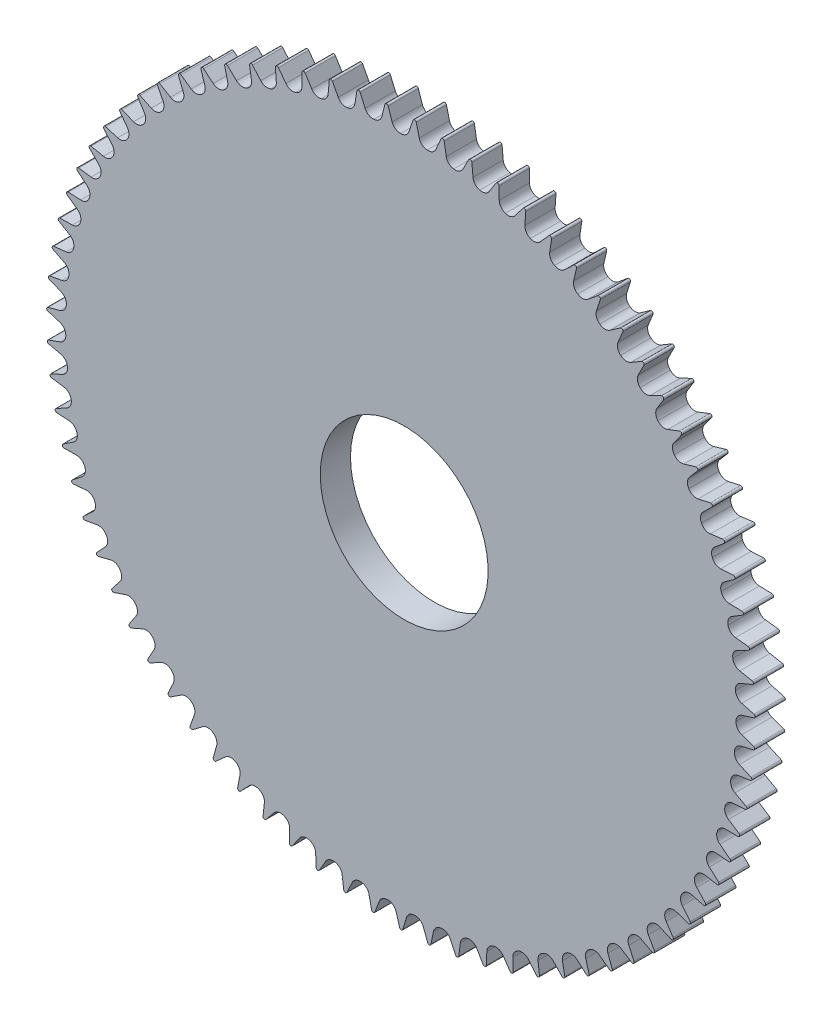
SolidWorks part; units mm, degrees
ref_plane "Plan1" through (0, 0, 0) normal (0, 0, 1) x (1, 0, 0)
ref_plane "Plan2" through (0, 0, 0) normal (0, 1, 0) x (1, 0, 0)
ref_plane "Plan3" through (0, 0, 0) normal (1, 0, 0) x (0, 0, -1)
sketch "Esquisse1" plane through (0, 0, 0) normal (0, 0, 1) x (1, 0, 0)
  line L0 (-13.3047, 202.9744) -> (-11.4948, 210.2179)
  line L1 (-9.5775, 210.2961) -> (-7.1837, 203.224)
  line L2 (-29.3871, 201.4322) -> (-28.1584, 208.7966)
  line L3 (-26.2533, 209.0269) -> (-23.3053, 202.1674)
  line L4 (-45.2961, 198.6172) -> (-44.6564, 206.0559)
  line L5 (-42.7756, 206.4368) -> (-39.2919, 199.8332)
  line L6 (-60.9311, 194.547) -> (-60.8844, 202.0131)
  line L7 (-59.0398, 202.5422) -> (-55.0425, 196.2363)
  line L8 (-76.1933, 189.2476) -> (-76.74, 196.6937)
  line L9 (-74.9433, 197.3677) -> (-70.4576, 191.3993)
  line L10 (-90.9863, 182.7523) -> (-92.1228, 190.1314)
  line L11 (-90.3853, 190.9461) -> (-85.4396, 185.3529)
  line L12 (-105.2164, 175.1022) -> (-106.9356, 182.3678)
  line L13 (-105.2683, 183.3179) -> (-99.8939, 178.1353)
  line L14 (-118.7938, 166.3458) -> (-121.0848, 173.4517)
  line L15 (-119.4983, 174.5313) -> (-113.729, 169.7921)
  line L16 (2.8493, 203.234) -> (5.229, 210.3107)
  line L17 (7.1465, 210.2363) -> (8.9708, 202.9965)
  line L18 (-131.6325, 156.5382) -> (-134.4808, 163.4397)
  line L19 (-132.9851, 164.6419) -> (-126.8576, 160.3761)
  line L20 (-143.6514, 145.7417) -> (-147.0391, 152.3951)
  line L21 (-145.6436, 153.7123) -> (-139.1965, 149.9468)
  line L22 (-154.7746, 134.0244) -> (-158.6801, 140.3876)
  line L23 (-157.3937, 141.8115) -> (-150.6679, 138.5701)
  line L24 (-164.9316, 121.4604) -> (-169.3304, 127.4931)
  line L25 (-168.1612, 129.0148) -> (-161.1991, 126.318)
  line L26 (-174.0583, 108.1291) -> (-178.9225, 113.7933)
  line L27 (-177.8779, 115.403) -> (-170.7235, 113.2679)
  line L28 (-182.097, 94.1148) -> (-187.3959, 99.3747)
  line L29 (-186.4824, 101.0623) -> (-179.181, 99.5024)
  line L30 (-188.9969, 79.5062) -> (-194.6969, 84.3284)
  line L31 (-193.9204, 86.0833) -> (-186.5182, 85.1084)
  line L32 (-194.7143, 64.3955) -> (-200.7794, 68.7497)
  line L33 (-200.1448, 70.5607) -> (-192.6885, 70.177)
  line L34 (-199.213, 48.8784) -> (-205.6049, 52.7369)
  line L35 (-205.1162, 54.5926) -> (-197.653, 54.8025)
  line L36 (-202.4647, 33.0529) -> (-209.1429, 36.3914)
  line L37 (-208.8032, 38.28) -> (-201.3803, 39.0822)
  line L38 (-204.4488, 17.0191) -> (-211.3712, 19.8164)
  line L39 (-211.1826, 21.7261) -> (-203.8468, 23.1155)
  line L40 (-205.1528, 0.8783) -> (-212.2755, 3.1168)
  line L41 (-212.2392, 5.0355) -> (-205.037, 7.0033)
  line L42 (-204.5721, -15.2674) -> (-211.8501, -13.6018)
  line L43 (-211.9664, -11.6864) -> (-204.9433, -9.1525)
  line L44 (-202.7105, -31.3159) -> (-210.0978, -30.2338)
  line L45 (-210.3659, -28.3337) -> (-203.5664, -25.2499)
  line L46 (-199.5797, -47.1657) -> (-207.0296, -46.6741)
  line L47 (-207.4478, -44.8012) -> (-200.9148, -41.1869)
  line L48 (-195.1995, -62.7168) -> (-202.6649, -62.8185)
  line L49 (-203.2307, -60.9848) -> (-197.0054, -56.8629)
  line L50 (-189.5976, -77.8706) -> (-197.0314, -78.5652)
  line L51 (-197.741, -76.7822) -> (-191.863, -72.1788)
  line L52 (-182.8095, -92.5315) -> (-190.1646, -93.8145)
  line L53 (-191.0136, -92.0936) -> (-185.5199, -87.0376)
  line L54 (-174.878, -106.6067) -> (-182.1079, -108.47)
  line L55 (-183.091, -106.822) -> (-178.0163, -101.3455)
  line L56 (-165.8533, -120.0073) -> (-172.9123, -122.4391)
  line L57 (-174.0232, -120.8744) -> (-169.3997, -115.0121)
  line L58 (-155.7925, -132.6485) -> (-162.636, -135.6335)
  line L59 (-163.8677, -134.1619) -> (-159.7245, -127.9508)
  line L60 (-144.7591, -144.4504) -> (-151.3438, -147.9696)
  line L61 (-152.6885, -146.6006) -> (-149.052, -140.08)
  line L62 (-132.823, -155.3384) -> (-139.1072, -159.3697)
  line L63 (-140.5565, -158.1118) -> (-137.4495, -151.3228)
  line L64 (-120.0595, -165.2436) -> (-126.0036, -169.7614)
  line L65 (-127.5482, -168.6227) -> (-124.9904, -161.6083)
  line L66 (-106.5494, -174.1035) -> (-112.1158, -179.0793)
  line L67 (-113.7459, -178.0669) -> (-111.7535, -170.8715)
  line L68 (-92.3781, -181.8619) -> (-97.5315, -187.2643)
  line L69 (-99.237, -186.3846) -> (-97.8225, -179.0536)
  line L70 (-77.6351, -188.47) -> (-82.3431, -194.2647)
  line L71 (-84.1131, -193.5233) -> (-83.2855, -186.1031)
  line L72 (-62.4138, -193.8858) -> (-66.6465, -200.0362)
  line L73 (-68.4698, -199.4378) -> (-68.2344, -191.9753)
  line L74 (-46.8103, -198.0752) -> (-50.5409, -204.5424)
  line L75 (-52.406, -204.0908) -> (-52.7643, -196.6332)
  line L76 (-30.9233, -201.0116) -> (-34.1283, -207.7548)
  line L77 (-36.0233, -207.4527) -> (-36.973, -200.0472)
  line L78 (-14.8532, -202.6765) -> (-17.5123, -209.653)
  line L79 (-19.4254, -209.5025) -> (-20.9604, -202.1958)
  line L80 (1.2984, -203.0594) -> (-0.798, -210.2251)
  line L81 (-2.717, -210.227) -> (-4.8277, -203.0654)
  line L82 (17.4294, -202.1578) -> (15.9089, -209.4675)
  line L83 (13.9961, -209.6218) -> (11.3231, -202.6505)
  line L84 (33.4377, -199.9774) -> (32.5027, -207.3848)
  line L85 (30.6083, -207.6907) -> (27.3899, -200.9538)
  line L86 (49.2222, -196.5321) -> (48.8787, -203.9904)
  line L87 (47.0145, -204.4458) -> (43.2711, -197.9859)
  line L88 (64.683, -191.8436) -> (64.9332, -199.3056)
  line L89 (63.1111, -199.9077) -> (58.8662, -193.7656)
  line L90 (79.7225, -185.9416) -> (80.5648, -193.3601)
  line L91 (78.7963, -194.105) -> (74.0768, -188.3196)
  line L92 (94.2455, -178.8633) -> (95.6745, -186.1914)
  line L93 (93.9708, -187.0745) -> (88.8066, -181.6824)
  line L94 (108.1603, -170.6535) -> (110.167, -177.845)
  line L95 (108.5388, -178.8606) -> (102.9625, -173.8958)
  line L96 (121.3788, -161.3642) -> (123.9505, -168.3735)
  line L97 (122.4081, -169.5153) -> (116.4551, -165.0092)
  line L98 (133.8174, -151.054) -> (136.9379, -157.8368)
  line L99 (135.4911, -159.0975) -> (129.1989, -155.0787)
  line L100 (145.3976, -139.7882) -> (149.0471, -146.3016)
  line L101 (147.7051, -147.6733) -> (141.1134, -144.1671)
  line L102 (156.0461, -127.6379) -> (160.2016, -133.8408)
  line L103 (158.9728, -135.3148) -> (152.1234, -132.3433)
  line L104 (165.6956, -114.68) -> (170.3308, -120.5331)
  line L105 (169.223, -122.1001) -> (162.1592, -119.6822)
  line L106 (174.2851, -100.9964) -> (179.3707, -106.4628)
  line L107 (178.3909, -108.1128) -> (171.1573, -106.2638)
  line L108 (181.7603, -86.6737) -> (187.2641, -91.7187)
  line L109 (186.4185, -93.4413) -> (179.0608, -92.1729)
  line L110 (188.0739, -71.8023) -> (193.9611, -76.3941)
  line L111 (193.255, -78.1784) -> (185.8199, -77.4986)
  line L112 (193.1861, -56.4763) -> (199.4194, -60.5858)
  line L113 (198.8574, -62.4206) -> (191.3917, -62.3337)
  line L114 (197.0644, -40.7925) -> (203.6045, -44.3939)
  line L115 (203.19, -46.2675) -> (195.7411, -46.774)
  line L116 (199.6843, -24.8503) -> (206.49, -27.9206)
  line L117 (206.2256, -29.8213) -> (198.8404, -30.918)
  line L118 (201.0294, -8.7502) -> (208.0575, -11.2702)
  line L119 (207.945, -13.1858) -> (200.6703, -14.8658)
  line L120 (201.0911, 7.4058) -> (208.2971, 5.4522)
  line L121 (208.3372, 3.5336) -> (201.2189, 1.281)
  line L122 (199.8689, 23.5156) -> (207.2074, 22.1407)
  line L123 (207.3998, 20.2314) -> (200.483, 17.4203)
  line L124 (197.3708, 39.4774) -> (204.7953, 38.6899)
  line L125 (205.1387, 36.8019) -> (198.4672, 33.4502)
  line L126 (193.6123, 55.1902) -> (201.0759, 54.9951)
  line L127 (201.5683, 53.1404) -> (195.1841, 49.2692)
  line L128 (188.6173, 70.5548) -> (196.0729, 70.9533)
  line L129 (196.711, 69.1436) -> (190.6546, 64.7774)
  line L130 (182.4174, 85.474) -> (189.8177, 86.4636)
  line L131 (190.5977, 84.7102) -> (184.9073, 79.8767)
  line L132 (175.0518, 99.8534) -> (182.3501, 101.4278)
  line L133 (183.2669, 99.742) -> (177.9785, 94.4716)
  line L134 (166.567, 113.6022) -> (173.7171, 115.7515)
  line L135 (174.765, 114.1438) -> (169.912, 108.4699)
  line L136 (157.0167, 126.6334) -> (163.9735, 129.3439)
  line L137 (165.1457, 127.8246) -> (160.7589, 121.7831)
  line L138 (146.4613, 138.8646) -> (153.1807, 142.1193)
  line L139 (154.4699, 140.6979) -> (150.577, 134.327)
  line L140 (134.9674, 150.2185) -> (141.407, 153.9968)
  line L141 (142.8051, 152.6823) -> (139.4306, 146.0222)
  line L142 (122.6078, 160.6233) -> (128.7269, 164.9013)
  line L143 (130.225, 163.7021) -> (127.3903, 156.7949)
  line L144 (109.4606, 170.0133) -> (115.2204, 174.7639)
  line L145 (116.8091, 173.6875) -> (114.5322, 166.577)
  line L146 (95.609, 178.329) -> (100.9731, 183.5222)
  line L147 (102.6423, 182.5754) -> (100.9375, 175.3065)
  line L148 (81.1404, 185.518) -> (86.075, 191.121)
  line L149 (87.8141, 190.3098) -> (86.6922, 182.9284)
  line L150 (66.1464, 191.5347) -> (70.6203, 197.512)
  line L151 (72.4183, 196.8415) -> (71.8864, 189.3943)
  line L152 (50.7218, 196.3411) -> (54.7066, 202.6549)
  line L153 (56.5523, 202.1294) -> (56.6137, 194.6635)
  line L154 (34.9641, 199.9068) -> (38.4347, 206.5173)
  line L155 (40.3162, 206.1401) -> (40.9707, 198.7027)
  line L156 (18.9729, 202.2093) -> (21.9073, 209.0746)
  line L157 (23.8128, 208.8481) -> (25.0561, 201.4862)
  line L158 (-1.9659, 0.1027) -> (-2.164, 199.777) construction
  line L159 (-1.9659, 0.1027) -> (-18.0275, 199.13) construction
  circle A0 centre (0, 0) radius 204.75 construction
  arc A1 (-2.164, 199.777) -> (2.8493, 203.234) centre (-1.9658, 204.8531) ccw
  arc A2 (8.9708, 202.9965) -> (13.7008, 199.1615) centre (13.8968, 204.2377) ccw
  arc A3 (-18.0275, 199.13) -> (-13.3047, 202.9744) centre (-18.2332, 204.2059) ccw
  arc A4 (-11.4948, 210.2179) -> (-9.5775, 210.2961) centre (-10.5247, 209.9755) cw
  arc A5 (-7.1837, 203.224) -> (-2.164, 199.777) centre (-2.3719, 204.8527) ccw
  arc A6 (-33.7895, 197.2248) -> (-29.3871, 201.4322) centre (-34.3978, 202.2682) ccw
  arc A7 (-28.1584, 208.7966) -> (-26.2533, 209.0269) centre (-27.172, 208.632) cw
  arc A8 (-23.3053, 202.1674) -> (-18.0275, 199.13) centre (-18.638, 204.1732) ccw
  arc A9 (-49.3502, 194.0733) -> (-45.2961, 198.6172) centre (-50.3574, 199.0524) ccw
  arc A10 (-44.6564, 206.0559) -> (-42.7756, 206.4368) centre (-43.66, 205.9702) cw
  arc A11 (-39.2919, 199.8332) -> (-33.7895, 197.2248) centre (-34.7988, 202.2035) ccw
  arc A12 (-64.6115, 189.6954) -> (-60.9311, 194.547) centre (-66.011, 194.5788) ccw
  arc A13 (-60.8844, 202.0131) -> (-59.0398, 202.5422) centre (-59.8844, 202.0068) cw
  arc A14 (-55.0425, 196.2363) -> (-49.3502, 194.0733) centre (-50.7519, 198.9561) ccw
  arc A15 (-79.4766, 184.1189) -> (-76.1933, 189.2476) centre (-81.2597, 188.8756) ccw
  arc A16 (-76.74, 196.6937) -> (-74.9433, 197.3677) centre (-75.7427, 196.7669) cw
  arc A17 (-70.4576, 191.3993) -> (-64.6115, 189.6954) centre (-66.3966, 194.4514) ccw
  arc A18 (-93.8517, 177.3789) -> (-90.9863, 182.7523) centre (-96.0071, 181.979) ccw
  arc A19 (-92.1228, 190.1314) -> (-90.3853, 190.9461) centre (-91.1345, 190.2837) cw
  arc A20 (-85.4396, 185.3529) -> (-79.4766, 184.1189) centre (-81.634, 188.718) ccw
  arc A21 (-107.6458, 169.5182) -> (-105.2164, 175.1022) centre (-110.1599, 173.9325) ccw
  arc A22 (-106.9356, 182.3678) -> (-105.2683, 183.3179) centre (-105.9625, 182.598) cw
  arc A23 (-99.8939, 178.1353) -> (-93.8517, 177.3789) centre (-96.3677, 181.7921) ccw
  arc A24 (-120.7719, 160.5864) -> (-118.7938, 166.3458) centre (-123.6287, 164.7869) ccw
  arc A25 (-121.0848, 173.4517) -> (-119.4983, 174.5313) centre (-120.133, 173.7586) cw
  arc A26 (-113.729, 169.7921) -> (-107.6458, 169.5182) centre (-110.5045, 173.7175) ccw
  arc A27 (-133.1467, 150.6399) -> (-131.6325, 156.5382) centre (-136.3283, 154.6002) ccw
  arc A28 (-134.4808, 163.4397) -> (-132.9851, 164.6419) centre (-133.5565, 163.8212) cw
  arc A29 (-126.8576, 160.3761) -> (-120.7719, 160.5864) centre (-123.9551, 164.5453) ccw
  arc A30 (-144.6923, 139.7417) -> (-143.6514, 145.7417) centre (-148.1784, 143.4367) ccw
  arc A31 (-147.0391, 152.3951) -> (-145.6436, 153.7123) centre (-146.1479, 152.8488) cw
  arc A32 (-139.1965, 149.9468) -> (-133.1467, 150.6399) centre (-136.6345, 154.3334) ccw
  arc A33 (-155.3354, 127.9606) -> (-154.7746, 134.0244) centre (-159.1041, 131.367) ccw
  arc A34 (5.229, 210.3107) -> (7.1465, 210.2363) centre (6.1768, 209.992) cw
  arc A35 (-158.6801, 140.3876) -> (-157.3937, 141.8115) centre (-157.8279, 140.9107) cw
  arc A36 (-150.6679, 138.5701) -> (-144.6923, 139.7417) centre (-148.4624, 143.1464) ccw
  arc A37 (-165.0089, 115.3712) -> (-164.9316, 121.4604) centre (-169.0363, 118.4674) ccw
  arc A38 (-169.3304, 127.4931) -> (-168.1612, 129.0148) centre (-168.5224, 128.0823) cw
  arc A39 (-161.1991, 126.318) -> (-155.3354, 127.9606) centre (-159.3642, 131.0551) ccw
  arc A40 (-173.6516, 102.0531) -> (-174.0583, 108.1291) centre (-177.9123, 104.8195) ccw
  arc A41 (-178.9225, 113.7933) -> (-177.8779, 115.403) centre (-178.1639, 114.4448) cw
  arc A42 (-170.7235, 113.2679) -> (-165.0089, 115.3712) centre (-169.2708, 118.1358) ccw
  arc A43 (-181.2089, 88.0903) -> (-182.097, 94.1148) centre (-185.6759, 90.5095) ccw
  arc A44 (-187.3959, 99.3747) -> (-186.4824, 101.0623) centre (-186.6914, 100.0844) cw
  arc A45 (-179.181, 99.5024) -> (-173.6516, 102.0531) centre (-178.1197, 104.4703) ccw
  arc A46 (-187.6329, 73.5713) -> (-188.9969, 79.5062) centre (-192.278, 75.6279) ccw
  arc A47 (-194.6969, 84.3284) -> (-193.9204, 86.0833) centre (-194.051, 85.0919) cw
  arc A48 (-186.5182, 85.1084) -> (-181.2089, 88.0903) centre (-185.8548, 90.1449) ccw
  arc A49 (-192.883, 58.5878) -> (-194.7143, 64.3955) centre (-197.6768, 60.2688) ccw
  arc A50 (-200.7794, 68.7497) -> (-200.1448, 70.5607) centre (-200.1962, 69.562) cw
  arc A51 (-192.6885, 70.177) -> (-187.6329, 73.5713) centre (-192.4274, 75.2503) ccw
  arc A52 (-196.9262, 43.2345) -> (-199.213, 48.8784) centre (-201.8384, 44.5294) ccw
  arc A53 (-205.6049, 52.7369) -> (-205.1162, 54.5926) centre (-205.0881, 53.593) cw
  arc A54 (-197.653, 54.8025) -> (-192.883, 58.5878) centre (-197.7958, 59.8805) ccw
  arc A55 (-199.7367, 27.6085) -> (-202.4647, 33.0529) centre (-204.7363, 28.509) ccw
  arc A56 (-209.1429, 36.3914) -> (-208.8032, 38.28) centre (-208.6958, 37.2858) cw
  arc A57 (-201.3803, 39.0822) -> (-196.9262, 43.2345) centre (-201.9261, 44.1328) ccw
  arc A58 (-201.2969, 11.8087) -> (-204.4488, 17.0191) centre (-206.3521, 12.3091) ccw
  arc A59 (-211.3712, 19.8164) -> (-211.1826, 21.7261) centre (-210.9965, 20.7436) cw
  arc A60 (-203.8468, 23.1155) -> (-199.7367, 27.6085) centre (-204.7922, 28.1068) ccw
  arc A61 (-201.5968, -4.0652) -> (-205.1528, 0.8783) centre (-206.6759, -3.968) ccw
  arc A62 (-212.2755, 3.1168) -> (-212.2392, 5.0355) centre (-211.9756, 4.0708) cw
  arc A63 (-205.037, 7.0033) -> (-201.2969, 11.8087) centre (-206.376, 11.9037) ccw
  arc A64 (-200.6346, -19.9127) -> (-204.5721, -15.2674) centre (-205.7053, -20.2194) ccw
  arc A65 (-211.8501, -13.6018) -> (-211.9664, -11.6864) centre (-211.627, -12.627) cw
  arc A66 (-204.9433, -9.1525) -> (-201.5968, -4.0652) centre (-206.6674, -4.374) ccw
  arc A67 (-198.4163, -35.6337) -> (-202.7105, -31.3159) centre (-203.4467, -36.3422) ccw
  arc A68 (-210.0978, -30.2338) -> (-210.3659, -28.3337) centre (-209.9529, -29.2444) cw
  arc A69 (-203.5664, -25.2499) -> (-200.6346, -19.9127) centre (-205.6646, -20.6234) ccw
  arc A70 (-194.956, -51.1288) -> (-199.5797, -47.1657) centre (-199.9142, -52.2347) ccw
  arc A71 (-207.0296, -46.6741) -> (-207.4478, -44.8012) centre (-206.9638, -45.6762) cw
  arc A72 (-200.9148, -41.1869) -> (-198.4163, -35.6337) centre (-203.374, -36.7418) ccw
  arc A73 (-190.2756, -66.2999) -> (-195.1995, -62.7168) centre (-195.1302, -67.7963) ccw
  arc A74 (-202.6649, -62.8185) -> (-203.2307, -60.9848) centre (-202.6786, -61.8186) cw
  arc A75 (-197.0054, -56.8629) -> (-194.956, -51.1288) centre (-199.81, -52.6273) ccw
  arc A76 (-184.4046, -81.0512) -> (-189.5976, -77.8706) centre (-189.125, -82.9286) ccw
  arc A77 (-197.0314, -78.5652) -> (-197.741, -76.7822) centre (-197.1244, -77.5695) cw
  arc A78 (-191.863, -72.1788) -> (-190.2756, -66.2999) centre (-194.9952, -68.1793) ccw
  arc A79 (-177.3802, -95.2895) -> (-182.8095, -92.5315) centre (-181.9365, -97.5359) ccw
  arc A80 (-190.1646, -93.8145) -> (-191.0136, -92.0936) centre (-190.3364, -92.8294) cw
  arc A81 (-185.5199, -87.0376) -> (-184.4046, -81.0512) centre (-188.96, -83.2997) ccw
  arc A82 (-169.2468, -108.9246) -> (-174.878, -106.6067) centre (-173.6102, -111.526) ccw
  arc A83 (-182.1079, -108.47) -> (-183.091, -106.822) centre (-182.3575, -107.5017) cw
  arc A84 (-178.0163, -101.3455) -> (-177.3802, -95.2895) centre (-181.7425, -97.8927) ccw
  arc A85 (-160.0557, -121.8705) -> (-165.8533, -120.0073) centre (-164.1987, -124.8103) ccw
  arc A86 (-172.9123, -122.4391) -> (-174.0232, -120.8744) centre (-173.2381, -121.4936) cw
  arc A87 (-169.3997, -115.0121) -> (-169.2468, -108.9246) centre (-173.3885, -111.8662) ccw
  arc A88 (-149.8652, -134.0452) -> (-155.7925, -132.6485) centre (-153.7615, -137.3048) ccw
  arc A89 (-162.636, -135.6335) -> (-163.8677, -134.1619) centre (-163.0358, -134.7169) cw
  arc A90 (-159.7245, -127.9508) -> (-160.0557, -121.8705) centre (-163.9506, -125.1318) ccw
  arc A91 (-138.7396, -145.3717) -> (-144.7591, -144.4504) centre (-142.3646, -148.9306) ccw
  arc A92 (-151.3438, -147.9696) -> (-152.6885, -146.6006) centre (-151.8152, -147.0877) cw
  arc A93 (-149.052, -140.08) -> (-149.8652, -134.0452) centre (-153.4886, -137.6056) ccw
  arc A94 (-126.7493, -155.7785) -> (-132.823, -155.3384) centre (-130.08, -159.6142) ccw
  arc A95 (-139.1072, -159.3697) -> (-140.5565, -158.1118) centre (-139.6472, -158.528) cw
  arc A96 (-137.4495, -151.3228) -> (-138.7396, -145.3717) centre (-142.0687, -149.2088) ccw
  arc A97 (-113.97, -165.1998) -> (-120.0595, -165.2436) centre (-116.9855, -169.288) ccw
  arc A98 (-126.0036, -169.7614) -> (-127.5482, -168.6227) centre (-126.6087, -168.9653) cw
  arc A99 (-124.9904, -161.6083) -> (-126.7493, -155.7785) centre (-129.763, -159.868) ccw
  arc A100 (-100.4826, -173.576) -> (-106.5494, -174.1035) centre (-103.1638, -177.8908) ccw
  arc A101 (-112.1158, -179.0793) -> (-113.7459, -178.0669) centre (-112.7822, -178.3337) cw
  arc A102 (-111.7535, -170.8715) -> (-113.97, -165.1998) centre (-116.6493, -169.5158) ccw
  arc A103 (-86.3724, -180.8542) -> (-92.3781, -181.8619) centre (-88.7023, -185.3684) ccw
  arc A104 (-97.5315, -187.2643) -> (-99.237, -186.3846) centre (-98.2551, -186.574) cw
  arc A105 (-97.8225, -179.0536) -> (-100.4826, -173.576) centre (-102.8105, -178.0912) ccw
  arc A106 (-71.7285, -186.9882) -> (-77.6351, -188.47) centre (-73.6924, -191.6733) ccw
  arc A107 (-82.3431, -194.2647) -> (-84.1131, -193.5233) centre (-83.1192, -193.6341) cw
  arc A108 (-83.2855, -186.1031) -> (-86.3724, -180.8542) centre (-88.3342, -185.5401) ccw
  arc A109 (-56.6436, -191.9395) -> (-62.4138, -193.8858) centre (-58.229, -196.7657) ccw
  arc A110 (-66.6465, -200.0362) -> (-68.4698, -199.4378) centre (-67.4703, -199.4693) cw
  arc A111 (-68.2344, -191.9753) -> (-71.7285, -186.9882) centre (-73.3118, -191.8152) ccw
  arc A112 (-41.213, -195.6765) -> (-46.8103, -198.0752) centre (-42.4099, -200.6135) ccw
  arc A113 (-50.5409, -204.5424) -> (-52.406, -204.0908) centre (-51.4071, -204.0428) cw
  arc A114 (-52.7643, -196.6332) -> (-56.6436, -191.9395) centre (-57.8384, -196.8769) ccw
  arc A115 (-25.5342, -198.1758) -> (-30.9233, -201.0116) centre (-26.3351, -203.1923) ccw
  arc A116 (-34.1283, -207.7548) -> (-36.0233, -207.4527) centre (-35.0315, -207.3255) cw
  arc A117 (-36.973, -200.0472) -> (-41.213, -195.6765) centre (-42.0117, -200.6933) ccw
  arc A118 (-9.7064, -199.4215) -> (-14.8532, -202.6765) centre (-10.1063, -204.4858) ccw
  arc A119 (-17.5123, -209.653) -> (-19.4254, -209.5025) centre (-18.4467, -209.2969) cw
  arc A120 (-20.9604, -202.1958) -> (-25.5342, -198.1758) centre (-25.9318, -203.2402) ccw
  arc A121 (6.1703, -199.4058) -> (1.2984, -203.0594) centre (6.174, -204.4858) ccw
  arc A122 (-0.798, -210.2251) -> (-2.717, -210.227) centre (-1.7578, -209.9443) cw
  arc A123 (-4.8277, -203.0654) -> (-9.7064, -199.4215) centre (-9.7004, -204.5015) ccw
  arc A124 (21.9955, -198.1287) -> (17.4294, -202.1578) centre (22.4029, -203.1923) ccw
  arc A125 (15.9089, -209.4675) -> (13.9961, -209.6218) centre (14.9298, -209.2638) cw
  arc A126 (11.3231, -202.6505) -> (6.1703, -199.4058) centre (6.5798, -204.4692) ccw
  arc A127 (37.6693, -195.5983) -> (33.4377, -199.9774) centre (38.4777, -200.6136) ccw
  arc A128 (32.5027, -207.3848) -> (30.6083, -207.6907) centre (31.5106, -207.2596) cw
  arc A129 (27.3899, -200.9538) -> (21.9955, -198.1287) centre (22.8061, -203.1436) ccw
  arc A130 (53.0925, -191.8306) -> (49.2222, -196.5321) centre (54.2968, -196.7658) ccw
  arc A131 (48.8787, -203.9904) -> (47.0145, -204.4458) centre (47.8798, -203.9444) cw
  arc A132 (43.2711, -197.9859) -> (37.6693, -195.5983) centre (38.8758, -200.533) ccw
  arc A133 (68.1676, -186.8495) -> (64.683, -191.8436) centre (69.7602, -191.6734) ccw
  arc A134 (64.9332, -199.3056) -> (63.1111, -199.9077) centre (63.9338, -199.3391) cw
  arc A135 (58.8662, -193.7656) -> (53.0925, -191.8306) centre (54.6872, -196.6538) ccw
  arc A136 (82.7993, -180.6864) -> (79.7225, -185.9416) centre (84.7701, -185.3685) ccw
  arc A137 (80.5648, -193.3601) -> (78.7963, -194.105) centre (79.5711, -193.4729) cw
  arc A138 (74.0768, -188.3196) -> (68.1676, -186.8495) centre (70.1404, -191.5308) ccw
  arc A139 (96.895, -173.3803) -> (94.2455, -178.8633) centre (99.2316, -177.891) ccw
  arc A140 (95.6745, -186.1914) -> (93.9708, -187.0745) centre (94.693, -186.3828) cw
  arc A141 (88.8066, -181.6824) -> (82.7993, -180.6864) centre (85.1378, -185.1961) ccw
  arc A142 (110.3658, -164.9773) -> (108.1603, -170.6535) centre (113.0533, -169.2882) ccw
  arc A143 (110.167, -177.845) -> (108.5388, -178.8606) centre (109.2038, -178.1138) cw
  arc A144 (102.9625, -173.8958) -> (96.895, -173.3803) centre (99.5845, -177.6899) ccw
  arc A145 (123.1263, -155.5307) -> (121.3788, -161.3642) centre (126.1479, -159.6144) ccw
  arc A146 (123.9505, -168.3735) -> (122.4081, -169.5153) centre (123.0117, -168.7179) cw
  arc A147 (116.4551, -165.0092) -> (110.3658, -164.9773) centre (113.3891, -169.0597) ccw
  arc A148 (135.096, -145.1001) -> (133.8174, -151.054) centre (138.4325, -148.9309) ccw
  arc A149 (136.9379, -157.8368) -> (135.4911, -159.0975) centre (136.0294, -158.2548) cw
  arc A150 (129.1989, -155.0787) -> (123.1263, -155.5307) centre (126.4645, -159.36) ccw
  arc A151 (146.1991, -133.7515) -> (145.3976, -139.7882) centre (149.8294, -137.3051) ccw
  arc A152 (149.0471, -146.3016) -> (147.7051, -147.6733) centre (148.1747, -146.7904) cw
  arc A153 (141.1134, -144.1671) -> (135.096, -145.1001) centre (138.7278, -148.6521) ccw
  arc A154 (156.3655, -121.5567) -> (156.0461, -127.6379) centre (160.2666, -124.8105) ccw
  arc A155 (160.2016, -133.8408) -> (158.9728, -135.3148) centre (159.3708, -134.3974) cw
  arc A156 (152.1234, -132.3433) -> (146.1991, -133.7515) centre (150.1016, -137.0037) ccw
  arc A157 (165.5308, -108.5926) -> (165.6956, -114.68) centre (169.6781, -111.5263) ccw
  arc A158 (170.3308, -120.5331) -> (169.223, -122.1001) centre (169.5468, -121.154) cw
  arc A159 (162.1592, -119.6822) -> (156.3655, -121.5567) centre (160.5141, -124.4885) ccw
  arc A160 (173.6372, -94.9414) -> (174.2851, -100.9964) centre (178.0045, -97.5362) ccw
  arc A161 (179.3707, -106.4628) -> (178.3909, -108.1128) centre (178.6385, -107.1439) cw
  arc A162 (171.1573, -106.2638) -> (165.5308, -108.5926) centre (169.8992, -111.1856) ccw
  arc A163 (180.6334, -80.6892) -> (181.7603, -86.6737) centre (185.193, -82.9289) ccw
  arc A164 (187.2641, -91.7187) -> (186.4185, -93.4413) centre (186.5884, -92.4559) cw
  arc A165 (179.0608, -92.1729) -> (173.6372, -94.9414) centre (178.1978, -97.1791) ccw
  arc A166 (186.4751, -65.9263) -> (188.0739, -71.8023) centre (191.1982, -67.7966) ccw
  arc A167 (193.9611, -76.3941) -> (193.255, -78.1784) centre (193.3461, -77.1826) cw
  arc A168 (185.8199, -77.4986) -> (180.6334, -80.6892) centre (185.3573, -82.5575) ccw
  arc A169 (191.1254, -50.7459) -> (193.1861, -56.4763) centre (195.9822, -52.235) ccw
  arc A170 (199.4194, -60.5858) -> (198.8574, -62.4206) centre (198.869, -61.4207) cw
  arc A171 (191.3917, -62.3337) -> (186.4751, -65.9263) centre (191.3325, -67.4133) ccw
  arc A172 (194.5549, -35.244) -> (197.0644, -40.7925) centre (199.5147, -36.3426) ccw
  arc A173 (203.6045, -44.3939) -> (203.19, -46.2675) centre (203.1222, -45.2698) cw
  arc A174 (195.7411, -46.774) -> (191.1254, -50.7459) centre (196.0857, -51.8423) ccw
  arc A175 (196.742, -19.5187) -> (199.6843, -24.8503) centre (201.7734, -20.2197) ccw
  arc A176 (206.49, -27.9206) -> (206.2256, -29.8213) centre (206.0787, -28.8321) cw
  arc A177 (198.8404, -30.918) -> (194.5549, -35.244) centre (199.5866, -35.9429) ccw
  arc A178 (197.6728, -3.6693) -> (201.0294, -8.7502) centre (202.744, -3.9683) ccw
  arc A179 (208.0575, -11.2702) -> (207.945, -13.1858) centre (207.72, -12.2115) cw
  arc A180 (200.6703, -14.8658) -> (196.742, -19.5187) centre (201.8133, -19.8155) ccw
  arc A181 (197.3414, 12.204) -> (201.0911, 7.4058) centre (202.4203, 12.3088) ccw
  arc A182 (208.2971, 5.4522) -> (208.3372, 3.5336) centre (208.0355, 4.487) cw
  arc A183 (201.2189, 1.281) -> (197.6728, -3.6693) centre (202.7516, -3.5623) ccw
  arc A184 (195.7499, 28.0007) -> (199.8689, 23.5156) centre (200.8044, 28.5087) ccw
  arc A185 (207.2074, 22.1407) -> (207.3998, 20.2314) centre (207.0233, 21.1578) cw
  arc A186 (200.483, 17.4203) -> (197.3414, 12.204) centre (202.3957, 12.7142) ccw
  arc A187 (192.9084, 43.6211) -> (197.3708, 39.4774) centre (197.9066, 44.529) ccw
  arc A188 (204.7953, 38.6899) -> (205.1387, 36.8019) centre (204.6898, 37.6955) cw
  arc A189 (198.4672, 33.4502) -> (195.7499, 28.0007) centre (200.7477, 28.9109) ccw
  arc A190 (188.8348, 58.9663) -> (193.6123, 55.1902) centre (193.7451, 60.2685) ccw
  arc A191 (201.0759, 54.9951) -> (201.5683, 53.1404) centre (201.0498, 53.9955) cw
  arc A192 (195.1841, 49.2692) -> (192.9084, 43.6211) centre (197.8181, 44.9254) ccw
  arc A193 (183.5549, 73.9394) -> (188.6173, 70.5548) centre (188.3462, 75.6276) ccw
  arc A194 (196.0729, 70.9533) -> (196.711, 69.1436) centre (196.1262, 69.9548) cw
  arc A195 (190.6546, 64.7774) -> (188.8348, 58.9663) centre (193.6253, 60.6566) ccw
  arc A196 (177.1021, 88.4457) -> (182.4174, 85.474) centre (181.7441, 90.5092) ccw
  arc A197 (189.8177, 86.4636) -> (190.5977, 84.7102) centre (189.9503, 85.4724) cw
  arc A198 (184.9073, 79.8767) -> (183.5549, 73.9394) centre (188.196, 76.0049) ccw
  arc A199 (169.5172, 102.3934) -> (175.0518, 99.8534) centre (173.9806, 104.8192) ccw
  arc A200 (182.3501, 101.4278) -> (183.2669, 99.742) centre (182.561, 100.4503) cw
  arc A201 (177.9785, 94.4716) -> (177.1021, 88.4457) centre (181.5644, 90.8734) ccw
  arc A202 (160.8481, 115.6944) -> (166.567, 113.6022) centre (165.1046, 118.4671) ccw
  arc A203 (173.7171, 115.7515) -> (174.765, 114.1438) centre (174.005, 114.7938) cw
  arc A204 (169.912, 108.4699) -> (169.5172, 102.3934) centre (173.7725, 105.168) ccw
  arc A205 (151.1496, 128.2646) -> (157.0167, 126.6334) centre (155.1724, 131.3668) ccw
  arc A206 (163.9735, 129.3439) -> (165.1457, 127.8246) centre (164.3365, 128.4121) cw
  arc A207 (160.7589, 121.7831) -> (160.8481, 115.6944) centre (164.8695, 118.7983) ccw
  arc A208 (140.4831, 140.0245) -> (146.4613, 138.8646) centre (144.2467, 143.4365) ccw
  arc A209 (153.1807, 142.1193) -> (154.4699, 140.6979) centre (153.6166, 141.2193) cw
  arc A210 (150.577, 134.327) -> (151.1496, 128.2646) centre (154.9118, 131.6782) ccw
  arc A211 (128.916, 150.8998) -> (134.9674, 150.2185) centre (132.3967, 154.6) ccw
  arc A212 (141.407, 153.9968) -> (142.8051, 152.6823) centre (141.913, 153.1343) cw
  arc A213 (139.4306, 146.0222) -> (140.4831, 140.0245) centre (143.9622, 143.7262) ccw
  arc A214 (116.5214, 160.8217) -> (122.6078, 160.6233) centre (119.6971, 164.7867) ccw
  arc A215 (128.7269, 164.9013) -> (130.225, 163.7021) centre (129.2998, 164.0817) cw
  arc A216 (127.3903, 156.7949) -> (128.916, 150.8998) centre (132.0899, 154.8662) ccw
  arc A217 (103.3777, 169.7275) -> (109.4606, 170.0133) centre (106.2283, 173.9323) ccw
  arc A218 (115.2204, 174.7639) -> (116.8091, 173.6875) centre (115.8567, 173.9924) cw
  arc A219 (114.5322, 166.577) -> (116.5214, 160.8217) centre (119.3702, 165.0278) ccw
  arc A220 (89.568, 177.5608) -> (95.609, 178.329) centre (92.0755, 181.9788) ccw
  arc A221 (100.9731, 183.5222) -> (102.6423, 182.5754) centre (101.6687, 182.8038) cw
  arc A222 (100.9375, 175.3065) -> (103.3777, 169.7275) centre (105.8833, 174.1466) ccw
  arc A223 (75.1796, 184.2722) -> (81.1404, 185.518) centre (77.3281, 188.8755) ccw
  arc A224 (86.075, 191.121) -> (87.8141, 190.3098) centre (86.8255, 190.46) cw
  arc A225 (86.6922, 182.9284) -> (89.568, 177.5608) centre (91.7146, 182.165) ccw
  arc A226 (60.3034, 189.8193) -> (66.1464, 191.5347) centre (62.0794, 194.5787) ccw
  arc A227 (70.6203, 197.512) -> (72.4183, 196.8415) centre (71.4209, 196.9128) cw
  arc A228 (71.8864, 189.3943) -> (75.1796, 184.2722) centre (76.9535, 189.0324) ccw
  arc A229 (45.0335, 194.1669) -> (50.7218, 196.3411) centre (46.4258, 199.0523) ccw
  arc A230 (54.7066, 202.6549) -> (56.5523, 202.1294) centre (55.5523, 202.1212) cw
  arc A231 (56.6137, 194.6635) -> (60.3034, 189.8193) centre (61.6936, 194.7054) ccw
  arc A232 (29.4665, 197.2875) -> (34.9641, 199.9068) centre (30.4663, 202.2682) ccw
  arc A233 (38.4347, 206.5173) -> (40.3162, 206.1401) centre (39.3201, 206.0524) cw
  arc A234 (40.9707, 198.7027) -> (45.0335, 194.1669) centre (46.0311, 199.148) ccw
  arc A235 (13.7008, 199.1615) -> (18.9729, 202.2093) centre (14.3017, 204.2058) ccw
  arc A236 (21.9073, 209.0746) -> (23.8128, 208.8481) centre (22.8268, 208.6816) cw
  arc A237 (25.0561, 201.4862) -> (29.4665, 197.2875) centre (30.0652, 202.3321) ccw
  point P70 (6.3144, 213.5386)
  dimension "D1" = 409.5
  dimension "D2" = 10.16
  dimension "D3" = 10.16
  dimension "D7" = 4.557
  dimension "D8" = 1
  dimension "D4" = 15.8745
  dimension "D5" = 12
  dimension "D6" = 12
extrude "Extrusion1" add sketch "Esquisse1" along normal blind 18 contours A237 L157 A236 L156 A235 A2 L17 A34 L16 A1 A5 L1 A4 L0 A3 A8 L3 A7 L2 A6 A11 L5 A10 L4 A9 A14 L7 A13 L6 A12 A17 L9 A16 L8 A15 A20 L11 A19 L10 A18 A23 L13 A22 L12 A21 A26 L15 A25 L14 A24 A29
sketch "Esquisse3" plane through (0, 0, 0) normal (0, 0, -1) x (-1, 0, 0)
  circle A0 centre (0, 0) radius 50
  dimension "D1" = 100
extrude "Enlèv. mat.-Extru.1" cut sketch "Esquisse3" against normal through all
